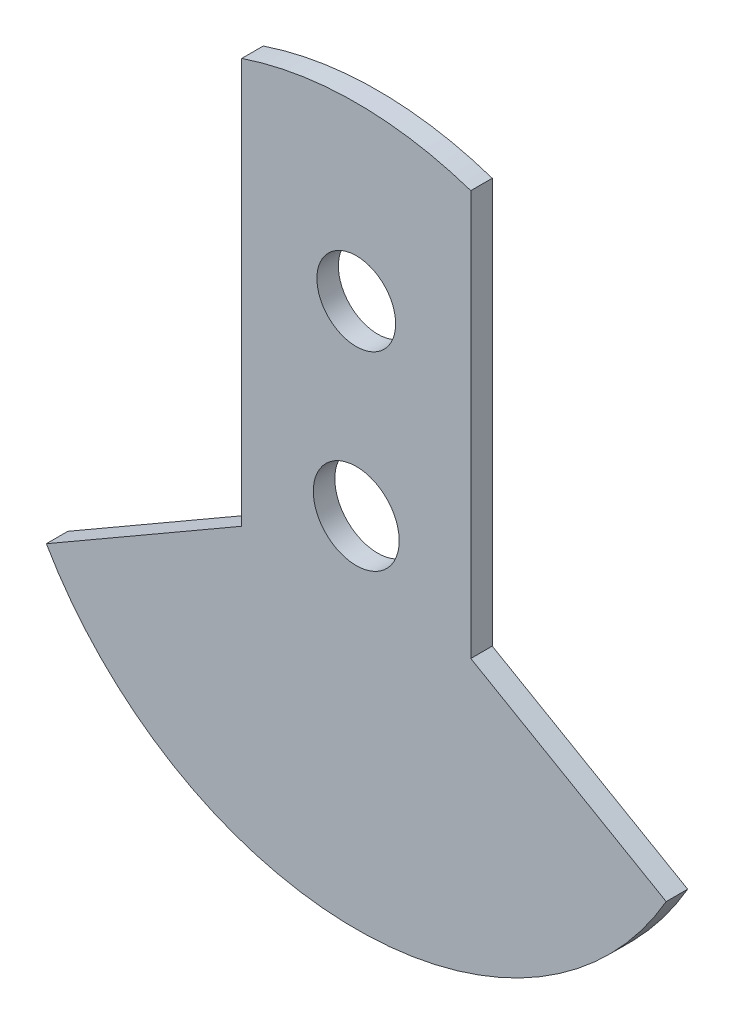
SolidWorks part; units mm, degrees
ref_plane "Front" through (0, 0, 0) normal (0, 0, 1) x (1, 0, 0)
ref_plane "Top" through (0, 0, 0) normal (0, 1, 0) x (1, 0, 0)
ref_plane "Right" through (0, 0, 0) normal (1, 0, 0) x (0, 0, -1)
sketch "Sketch1" plane through (0, 0, 0) normal (0, 0, 1) x (1, 0, 0)
  line L1 (8, -4.6188) -> (21.6506, -12.5)
  line L4 (8, -4.6188) -> (8, 23.6854)
  line L5 (-8, -4.6188) -> (-8, 23.6854)
  line L6 (-8, -4.6188) -> (-21.6506, -12.5)
  arc A0 (-21.6506, -12.5) -> (21.6506, -12.5) centre (0, 0) ccw
  circle A1 centre (0, 0) radius 3
  circle A2 centre (0, 13) radius 2.75
  arc A3 (8, 23.6854) -> (-8, 23.6854) centre (0, 0) ccw
extrude "Extrude1" add sketch "Sketch1" along normal blind 1.5
